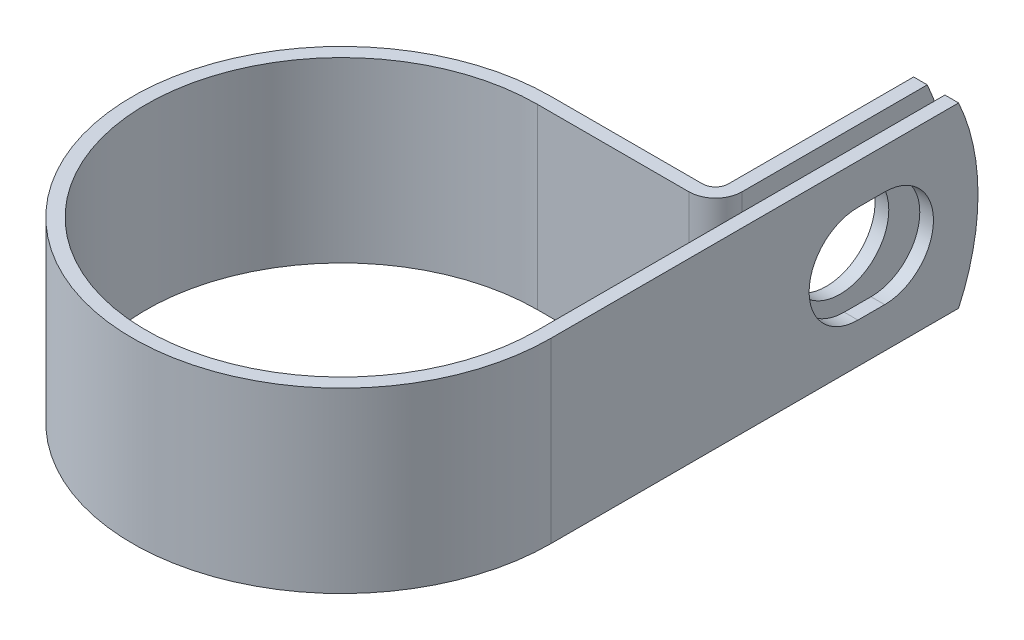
SolidWorks part; units mm, degrees
ref_plane "Front Plane" through (0, 0, 0) normal (0, 0, 1) x (1, 0, 0)
ref_plane "Top Plane" through (0, 0, 0) normal (0, 1, 0) x (1, 0, 0)
ref_plane "Right Plane" through (0, 0, 0) normal (1, 0, 0) x (0, 0, -1)
sketch "Sketch1" plane through (0, 0, 0) normal (0, 1, 0) x (1, 0, 0)
  line L0 (0, 17.4625) -> (13.5103, 17.4625)
  line L1 (17.4625, 0) -> (17.4625, 17.4625)
  line L2 (15.8877, 38.1) -> (15.8877, 19.8399)
  line L5 (17.4625, 17.4625) -> (17.4625, 38.1)
  arc A0 (0, 17.4625) -> (17.4625, 0) centre (0, 0) ccw
  arc A3 (13.5103, 17.4625) -> (15.8877, 19.8399) centre (13.5103, 19.8399) ccw
extrude "Extrude-Thin1" add sketch "Sketch1" along normal mid plane 15.875 thin
sketch "Sketch2" plane through (14.6685, 0, 0) normal (-1, 0, 0) x (0, 0, 1)
  line L0 (-38.1, 7.9375) -> (-38.1, -7.9375) construction
  line L7 (0, 7.9375) -> (0, -7.9375) construction
  circle A0 centre (-28.575, 0) radius 4.3561
  point P2 (-38.1, 0)
extrude "Cut-Extrude1" cut sketch "Sketch2" against normal up to surface (1.2192 mm away)
sketch "Sketch3" plane through (18.6817, 0, 0) normal (1, 0, 0) x (0, 0, -1)
  line L0 (27.3812, 0) -> (29.7688, 0) construction
  line L1 (27.3812, 4.3561) -> (29.7688, 4.3561)
  line L2 (27.3812, -4.3561) -> (29.7688, -4.3561)
  line L3 (38.1, 7.9375) -> (38.1, -7.9375) construction
  arc A0 (27.3812, 4.3561) -> (27.3812, -4.3561) centre (27.3812, 0) ccw
  arc A1 (29.7688, -4.3561) -> (29.7688, 4.3561) centre (29.7688, 0) ccw
  point P3 (28.575, 0)
  point P8 (38.1, 0)
  point P11 (23.0251, 0)
  point P12 (34.1249, 0)
extrude "Cut-Extrude2" cut sketch "Sketch3" against normal up to surface (1.2192 mm away)
sketch "Sketch4" plane through (14.6685, 0, 0) normal (-1, 0, 0) x (0, 0, 1)
  line L0 (-38.1, 7.9375) -> (-38.1, -7.9375)
  line L1 (-38.1, 7.9375) -> (-36.3676, 7.9375)
  line L2 (-38.1, 7.9375) -> (-19.8399, 7.9375) construction
  line L3 (-38.1, -7.9375) -> (-36.3676, -7.9375)
  line L4 (-38.1, -7.9375) -> (-19.8399, -7.9375) construction
  arc A0 (-36.3676, 7.9375) -> (-36.3676, -7.9375) centre (-19.05, 0) ccw
extrude "Cut-Extrude3" cut sketch "Sketch4" against normal through all contours A0 M4 M5 | A0 L0 M2
equation "\"D1@Sketch3\" = \"D2@Sketch2\""
equation "\"D7@Sketch1\" = \"D3@Sketch2\" + \"D1@Sketch3\""
equation "\"D1@Sketch4\" = ( \"D1@Extrude-Thin1\" + .125 ) * 2"
equation "\"D2@Sketch1\"=1.95*\"D5@Extrude-Thin1\""
equation "\"D2@Sketch3\" = \"D1@Sketch2\""
